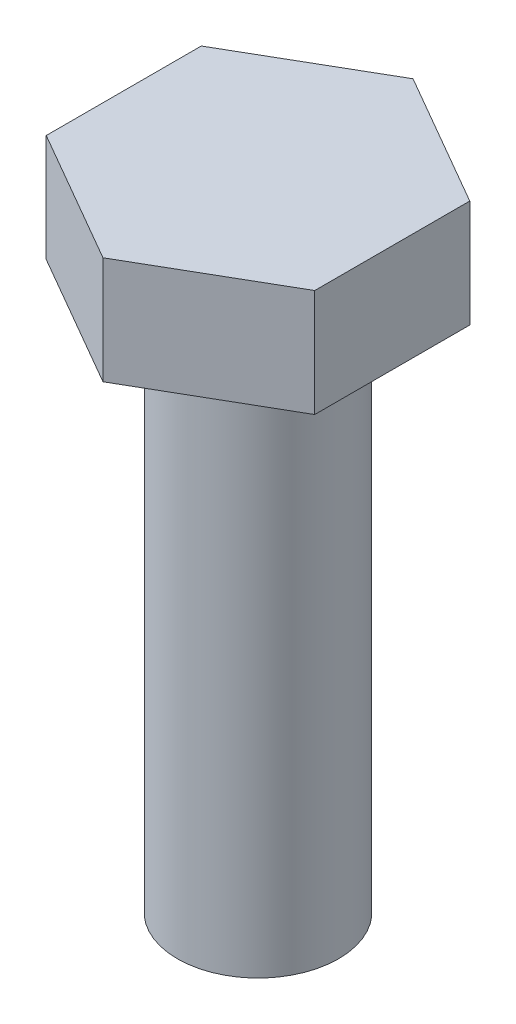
SolidWorks part; units mm, degrees
ref_plane "正面" through (0, 0, 0) normal (0, 0, 1) x (1, 0, 0)
ref_plane "平面" through (0, 0, 0) normal (0, 1, 0) x (1, 0, 0)
ref_plane "右側面" through (0, 0, 0) normal (1, 0, 0) x (0, 0, -1)
sketch "ｽｹｯﾁ1" plane through (0, 0, 0) normal (0, 1, 0) x (1, 0, 0)
  line L1 (0, 5.7735) -> (-5, 2.8868)
  line L2 (-5, 2.8868) -> (-5, -2.8868)
  line L3 (-5, -2.8868) -> (0, -5.7735)
  line L4 (0, -5.7735) -> (5, -2.8868)
  line L5 (5, -2.8868) -> (5, 2.8868)
  line L6 (5, 2.8868) -> (0, 5.7735)
  circle A0 centre (0, 0) radius 5 construction
  dimension "D1" = 10
extrude "押し出し1" add sketch "ｽｹｯﾁ1" along normal blind 4
sketch "ｽｹｯﾁ2" plane through (0, 0, 0) normal (0, 1, 0) x (1, 0, 0)
  circle A0 centre (0, 0) radius 3
  dimension "D1" = 6
extrude "押し出し2" add sketch "ｽｹｯﾁ2" against normal blind 20
